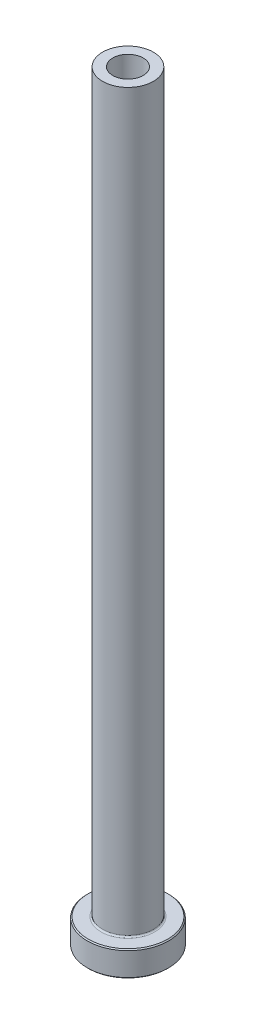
SolidWorks part; units mm, degrees
ref_plane "Front Plane" through (0, 0, 0) normal (0, 0, 1) x (1, 0, 0)
ref_plane "Top Plane" through (0, 0, 0) normal (0, 1, 0) x (1, 0, 0)
ref_plane "Right Plane" through (0, 0, 0) normal (1, 0, 0) x (0, 0, -1)
sketch "Sketch1" plane through (0, 0, 0) normal (0, 0, 1) x (1, 0, 0)
  line L0 (-3, 150) -> (-5, 150)
  line L1 (-5, 150) -> (-5, 5)
  line L2 (-5, 5) -> (-8, 5)
  line L3 (-8, 5) -> (-8, 0)
  line L4 (8.8, 0) -> (-8.8, 0) construction
  line L5 (-8, 0) -> (-3.25, 0)
  line L6 (-3, 105) -> (-3, 150)
  line L7 (0, 92.1877) -> (0, -15.5353) construction
  line L8 (0, -8.8) -> (0, 8.8) construction
  line L9 (-3, 105) -> (-3.25, 93)
  line L10 (-3.25, 93) -> (-3.25, 0)
  dimension "D1" = 0.25
  dimension "ID" = 6
  dimension "OD" = 10
  dimension "L" = 150
  dimension "H" = 16
  dimension "T" = 5
  dimension "N" = 45
  dimension "D2" = 12
revolve "Revolve1" add sketch "Sketch1" angle 360 about L7
fillet "Fillet1" radius 0.3 1 edges at (0, 5, 5)
chamfer "Chamfer1" distance 0.2 angle 45 2 edges at (0, 5, 8) (0, 0, 8)
chamfer "Chamfer3" distance 0.5 angle 45 1 edges at (0, 0, 3.25)
